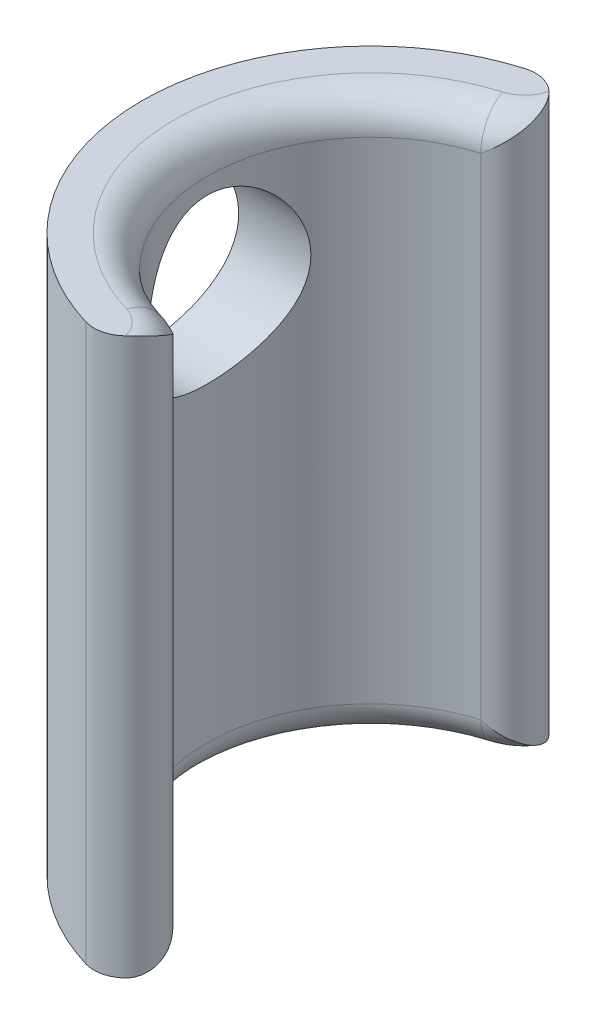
SolidWorks part; units mm, degrees
ref_plane "Front Plane" through (0, 0, 0) normal (0, 0, 1) x (1, 0, 0)
ref_plane "Top Plane" through (0, 0, 0) normal (0, 1, 0) x (1, 0, 0)
ref_plane "Right Plane" through (0, 0, 0) normal (1, 0, 0) x (0, 0, -1)
sketch "Sketch1" plane through (0, 0, 0) normal (0, 1, 0) x (1, 0, 0)
  line L0 (0, 7) -> (0, 6.7082)
  line L1 (0, -6.7082) -> (0, -7)
  arc A0 (-1.4286, 4.7916) -> (-1.4286, -4.7916) centre (0, 0) ccw
  arc A1 (0, 7) -> (0, -7) centre (0, 0) ccw
  circle A2 centre (0, 0) radius 7 construction
  circle A3 centre (0, 0) radius 5 construction
  arc A4 (-1.4286, -4.7916) -> (0, -6.7082) centre (-2, -6.7082) cw
  arc A5 (-1.4286, 4.7916) -> (0, 6.7082) centre (-2, 6.7082) ccw
  point P8 (0, 0)
  point P12 (0, -5)
  dimension "D1" = 10
  dimension "D3" = 2
  dimension "D2" = 2
extrude "Boss-Extrude1" add sketch "Sketch1" along normal blind 17
fillet "Fillet2" radius 1 8 edges at (-0.3964, 17, -5.513) (-5, 17, 0) (-0.3964, 17, 5.513) (-0.3964, 0, -5.513) (-5, 0, 0) (-0.3964, 0, 5.513) (0, 8.5, 7) (0, 8.5, -7)
sketch "Sketch2" plane through (0, 0, 0) normal (1, 0, 0) x (0, 0, -1)
  circle A1 centre (0, 13) radius 2.5
extrude "Cut-Extrude1" cut sketch "Sketch2" against normal through all both and the other way through all
